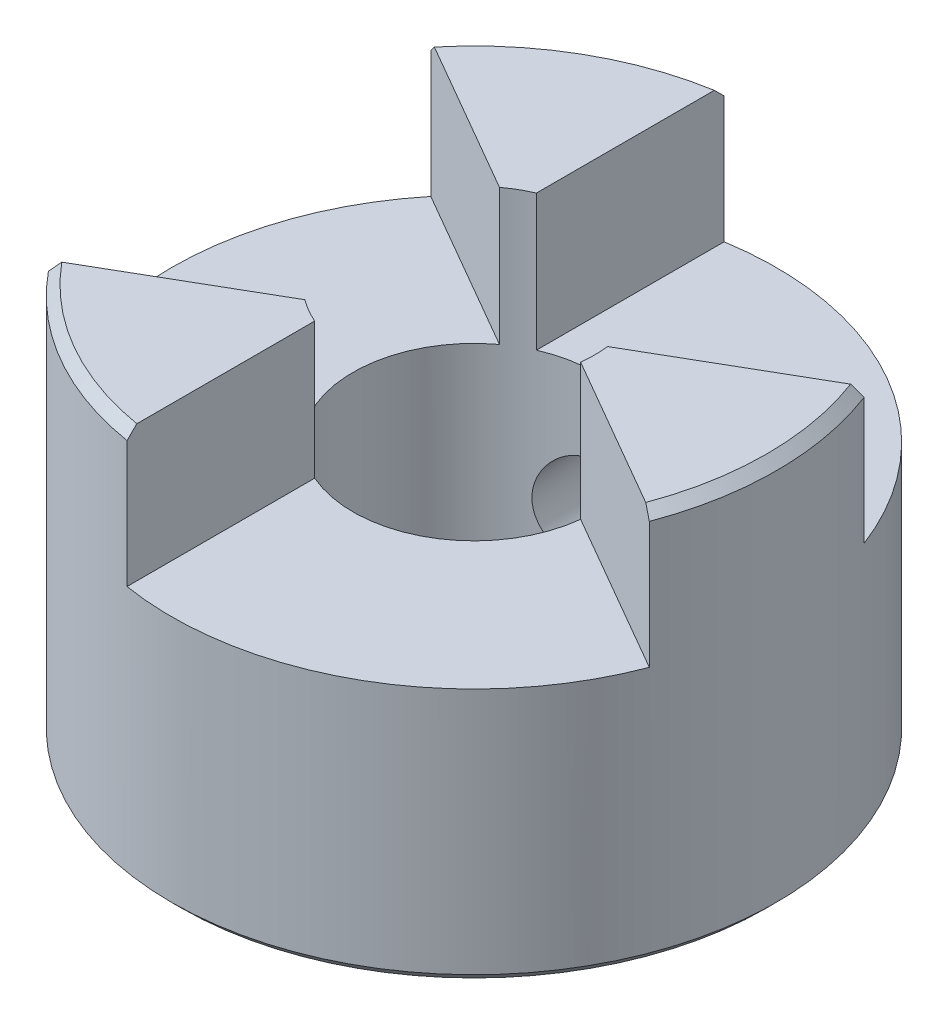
SolidWorks part; units mm, degrees
ref_plane "Front Plane" through (0, 0, 0) normal (0, 0, 1) x (1, 0, 0)
ref_plane "Top Plane" through (0, 0, 0) normal (0, 1, 0) x (1, 0, 0)
ref_plane "Right Plane" through (0, 0, 0) normal (1, 0, 0) x (0, 0, -1)
sketch "Sketch1" plane through (0, 0, 0) normal (0, 1, 0) x (1, 0, 0)
  circle A0 centre (0, 0) radius 7.9375
  dimension "D1" = 15.875
extrude "body" add sketch "Sketch1" along normal blind 6.7469
sketch "Sketch5" plane through (0, 0, 0) normal (0, 0, 1) x (1, 0, 0)
  line L0 (-7.9375, 6.7469) -> (7.9375, 0) construction
  circle A0 centre (0, 3.3734) radius 1.3526
  dimension "D1" = 2.7051
extrude "set screw" cut sketch "Sketch5" against normal through all
sketch "Sketch2" plane through (0, 6.7469, 0) normal (0, 1, 0) x (1, 0, 0)
  line L0 (0, 0) -> (7.9375, 0) construction
  line L1 (0, 0) -> (6.8741, 3.9688) construction
  line L2 (0, 0) -> (6.8741, -3.9688) construction
  line L3 (1.27, -0.7332) -> (7.4205, 2.8178) construction
  line L4 (1.27, 0.7332) -> (7.4205, -2.8178) construction
  line L5 (2.54, 0) -> (7.4205, 2.8178)
  line L6 (2.54, 0) -> (7.4205, -2.8178)
  line L7 (-1.27, -2.1997) -> (-1.27, -7.8352)
  line L8 (-1.27, -2.1997) -> (-6.1505, -5.0175)
  line L9 (-1.27, 2.1997) -> (-6.1505, 5.0175)
  line L10 (-1.27, 2.1997) -> (-1.27, 7.8352)
  circle A0 centre (0, 0) radius 7.9375 construction
  arc A1 (7.4205, 2.8178) -> (7.4205, -2.8178) centre (0, 0) cw
  arc A2 (-1.27, -7.8352) -> (-6.1505, -5.0175) centre (0, 0) cw
  arc A3 (-6.1505, 5.0175) -> (-1.27, 7.8352) centre (0, 0) cw
  dimension "D1" = 60
  dimension "D2" = 1.27
extrude "wings" add sketch "Sketch2" along normal offset from surface (3.5719 mm away) 10.3187
sketch "Sketch3" plane through (0, 0, 0) normal (0, -1, 0) x (1, 0, 0)
  circle A0 centre (0, 0) radius 3.175
  dimension "D1" = 6.35
extrude "bore" cut sketch "Sketch3" against normal through all
chamfer "chamfers" distance 0.254 angle 45 6 edges at (0, 0, -3.175) (0.2892, 2.0522, -7.9322) (-3.9688, 10.3188, 6.8741) (-3.9687, 10.3188, -6.8741) (7.9375, 10.3188, 0) (0, 0, 7.9375)
